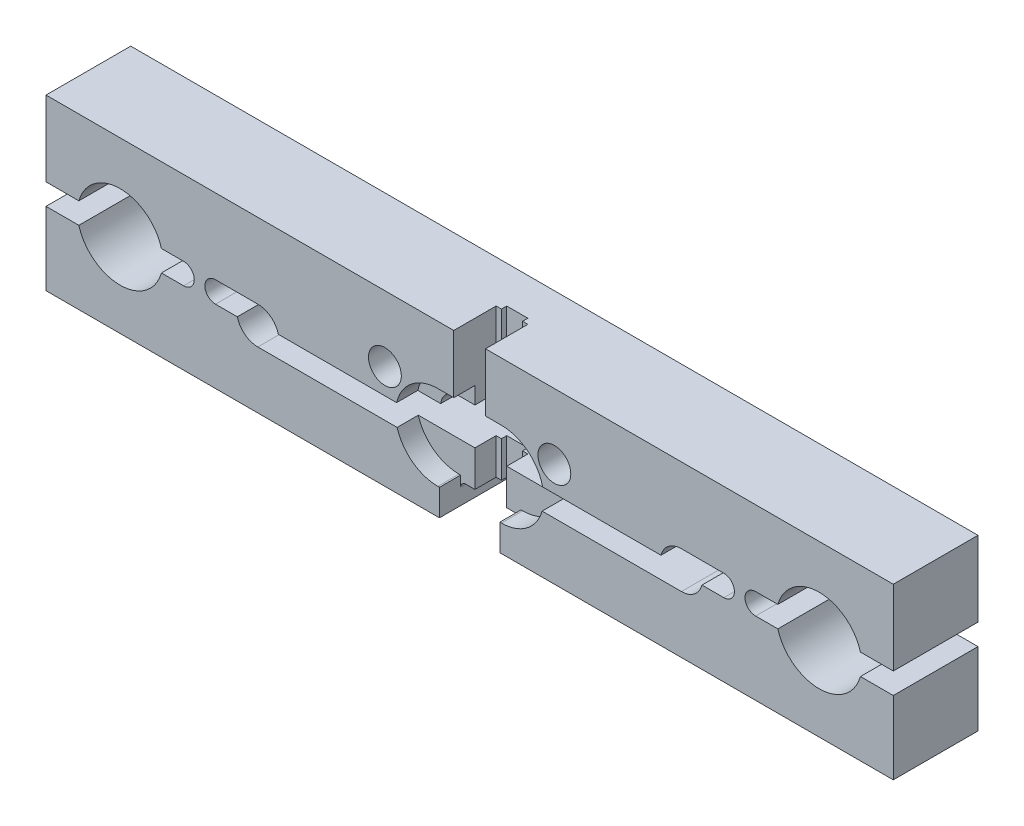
SolidWorks part; units mm, degrees
ref_plane "前视基准面" through (0, 0, 0) normal (0, 0, 1) x (1, 0, 0)
ref_plane "上视基准面" through (0, 0, 0) normal (0, 1, 0) x (1, 0, 0)
ref_plane "右视基准面" through (0, 0, 0) normal (1, 0, 0) x (0, 0, -1)
sketch "前视图草图" plane through (0, 0, 0) normal (0, 0, 1) x (1, 0, 0)
  line L0 (0, 0) -> (44.4821, 0) construction
  line L1 (0, 0) -> (0, 28.3185) construction
sketch "草图2" plane through (0, 0, 0) normal (0, 0, 1) x (1, 0, 0)
  line L0 (0, 0) -> (80, 0)
  line L1 (-200000, 0) -> (200044.4821, 0) construction
  line L2 (80, 0) -> (80, 16)
  line L3 (80, 16) -> (0, 16)
  line L4 (0, -200000) -> (0, 200028.3185) construction
  line L5 (0, 16) -> (0, 0)
  line L6 (7, 17.2957) -> (7, -8.7712) construction
  line L7 (73, 25.8617) -> (73, -10.6533) construction
  arc A0 (11.0488, 7.9) -> (2.9512, 7.9) centre (7, 7.8) ccw
  arc A2 (77.0488, 7.9) -> (68.9512, 7.9) centre (73, 7.8) ccw
  arc A3 (2.9512, 7.9) -> (11.0488, 7.9) centre (7, 8) ccw
  arc A4 (68.9512, 7.9) -> (77.0488, 7.9) centre (73, 8) ccw
  dimension "D3" = 7.8
  dimension "D5" = 8.1
  dimension "D9" = 8.1
  dimension "D10" = 8.1
  dimension "D11" = 8
  dimension "D12" = 8.1
  dimension "D1" = 16
  dimension "D2" = 80
  dimension "D4" = 7
  dimension "D7" = 7.8
  dimension "D14" = 8
  dimension "D21" = 7
extrude "凸台-拉伸1" add sketch "草图2" along normal blind 8
sketch "草图5" plane through (0, 0, 8) normal (0, 0, 1) x (1, 0, 0)
  line L0 (40, 9.8) -> (56.5376, 9.8) construction
  line L1 (0, -200000) -> (0, 200028.3185) construction
  line L2 (-200000, 0) -> (200044.4821, 0) construction
  circle A0 centre (40, 9.8) radius 8 construction
  circle A1 centre (48, 9.8) radius 1.55
  circle A2 centre (32, 9.8) radius 1.55
  dimension "D1" = 3.1
  dimension "D2" = 3.1
  dimension "D3" = 16
  dimension "D4" = 40
  dimension "D5" = 9.8
extrude "切除-拉伸3" cut sketch "草图5" against normal through all
sketch "草图6" plane through (0, 0, 8) normal (0, 0, 1) x (1, 0, 0)
  line L0 (-14.1885, 7.9) -> (-5.4375, 7.9) construction
  line L1 (-200000, 0) -> (200044.4821, 0) construction
  line L2 (0, 8.9) -> (0, 6.9)
  line L3 (0, -200000) -> (0, 200028.3185) construction
  line L4 (0, 6.9) -> (13, 6.9)
  line L5 (80, 0) -> (80, 16) construction
  line L6 (80, 6.9) -> (80, 8.9)
  line L7 (80, 8.9) -> (67, 8.9)
  line L10 (61.9365, 6.9) -> (64, 6.9)
  line L11 (20, 8.9) -> (16, 8.9)
  line L13 (20, 5.4) -> (60, 5.4)
  line L15 (58.0635, 7.4) -> (21.9365, 7.4)
  line L16 (20, 1015.1838) -> (20, 8.9) construction
  line L17 (60, 25.2492) -> (60, 8.9) construction
  line L18 (20, 5.4) -> (20, -1004.4799) construction
  line L20 (60, 5.4) -> (60, -19.6999) construction
  line L21 (16, 6.9) -> (18.0635, 6.9)
  line L25 (13, 8.9) -> (0, 8.9)
  line L26 (67, 6.9) -> (80, 6.9)
  line L27 (64, 8.9) -> (60, 8.9)
  arc A1 (20, 8.9) -> (22, 6.9) centre (20, 6.9) cw
  arc A2 (18, 7.4) -> (20, 5.4) centre (20, 7.4) ccw
  arc A3 (60, 5.4) -> (62, 7.4) centre (60, 7.4) ccw
  arc A4 (60, 8.9) -> (58, 6.9) centre (60, 6.9) ccw
  arc A5 (13, 6.9) -> (13, 8.9) centre (13, 7.9) ccw
  arc A6 (16, 8.9) -> (16, 6.9) centre (16, 7.9) ccw
  arc A7 (67, 8.9) -> (67, 6.9) centre (67, 7.9) ccw
  arc A8 (64, 6.9) -> (64, 8.9) centre (64, 7.9) ccw
  dimension "D5" = 13
  dimension "D1" = 7.9
  dimension "D2" = 2
  dimension "D3" = 1
  dimension "D4" = 20
  dimension "D6" = 2
  dimension "D7" = 0.5
  dimension "D8" = 16
  dimension "D9" = 20
  dimension "D10" = 13
  dimension "D11" = 16
extrude "切除-拉伸4" cut sketch "草图6" against normal through all
sketch "草图7" plane through (0, 0, 8) normal (0, 0, 1) x (1, 0, 0)
  line L0 (-200000, 0) -> (200044.4821, 0) construction
  line L1 (0, -200000) -> (0, 200028.3185) construction
  line L2 (80, 0) -> (80, 6.9) construction
  line L3 (77, -2) -> (74, -2)
  line L4 (77, 0) -> (74, 0)
  line L5 (6, 0) -> (3, 0)
  line L6 (6, -2) -> (3, -2)
  circle A0 centre (3, -1) radius 1
  circle A1 centre (6, -1) radius 1
  circle A2 centre (74, -1) radius 1
  circle A3 centre (77, -1) radius 1
  dimension "D1" = 2
  dimension "D2" = 2
  dimension "D3" = 2
  dimension "D4" = 2
  dimension "D5" = 3
  dimension "D6" = 6
  dimension "D7" = 3
  dimension "D8" = 6
sketch "草图8" plane through (0, 0, 8) normal (0, 0, 1) x (1, 0, 0)
  line L0 (38.5, 16) -> (41.5, 16)
  line L1 (80, 16) -> (0, 16) construction
  line L2 (41.5, 16) -> (41.5, 0)
  line L3 (-200000, 0) -> (200044.4821, 0) construction
  line L4 (41.5, 0) -> (38.5, 0)
  line L5 (38.5, 0) -> (38.5, 16)
  line L6 (0, -200000) -> (0, 200028.3185) construction
  dimension "D1" = 3
  dimension "D2" = 38.5
extrude "切除-拉伸5" cut sketch "草图8" against normal blind 4
sketch "草图9" plane through (0, 0, 8) normal (0, 0, 1) x (1, 0, 0)
  line L0 (37.15, 0) -> (42.85, 0)
  line L1 (-200000, 0) -> (200044.4821, 0) construction
  line L2 (42.85, 0) -> (42.85, 2)
  line L3 (42.85, 2) -> (37.15, 2)
  line L4 (37.15, 2) -> (37.15, 0)
  line L5 (0, -200000) -> (0, 200028.3185) construction
  circle A0 centre (37.65, 1.5) radius 0.5
  circle A1 centre (42.35, 1.5) radius 0.5
  point P4 (40, 0)
  dimension "D2" = 1
  dimension "D3" = 1
  dimension "D1" = 2
  dimension "D4" = 5.7
  dimension "D5" = 37.15
extrude "切除-拉伸6" cut sketch "草图9" against normal through all contours A0 | A1 | A1 L3 L0 L2 M18 | A0 L4 L3 M17 M18
sketch "草图10" plane through (0, 0, 8) normal (0, 0, 1) x (1, 0, 0)
  line L0 (-16.167, 6.5) -> (-7.3119, 6.5) construction
  line L1 (-200000, 0) -> (200044.4821, 0) construction
  line L2 (37, 25.4789) -> (37, 22.1592) construction
  line L3 (40, 28.0379) -> (40, 22.1592) construction
  line L4 (43, 28.0379) -> (43, 22.1592) construction
  line L5 (0, -200000) -> (0, 200028.3185) construction
  line L6 (80, 8.9) -> (80, 16) construction
  line L7 (37, 10.5) -> (43, 10.5)
  line L8 (43, 2.5) -> (37, 2.5)
  arc A0 (37, 10.5) -> (37, 2.5) centre (37, 6.5) ccw
  arc A1 (43, 2.5) -> (43, 10.5) centre (43, 6.5) ccw
  dimension "D5" = 8
  dimension "D6" = 8
  dimension "D1" = 6.5
  dimension "D2" = 40
  dimension "D3" = 37
  dimension "D4" = 37
extrude "切除-拉伸7" cut sketch "草图10" against normal blind 2
sketch "草图11" plane through (0, 0, 8) normal (0, 0, 1) x (1, 0, 0)
  line L0 (38.5, 5.4) -> (33.1542, 5.4) construction
  line L1 (46.8458, 5.4) -> (41.5, 5.4) construction
  line L2 (0, -200000) -> (0, 200028.3185) construction
  line L3 (80, 0) -> (80, 6.9) construction
  line L5 (37, 5.4) -> (43, 5.4)
  line L6 (37, 8.9) -> (43, 8.9)
  arc A0 (37, 8.9) -> (37, 5.4) centre (37, 7.15) ccw
  arc A1 (43, 5.4) -> (43, 8.9) centre (43, 7.15) ccw
  dimension "D1" = 3.5
  dimension "D2" = 3.5
  dimension "D3" = 37
  dimension "D4" = 37
extrude "切除-拉伸8" cut sketch "草图11" against normal through all
sketch "草图12" plane through (0, 0, 8) normal (0, 0, 1) x (1, 0, 0)
  line L0 (37.15, 0) -> (37.15, 2.5)
  line L1 (37, 2.5) -> (38.5, 2.5) construction
  line L2 (37.15, 2.5) -> (42.85, 2.5)
  line L3 (41.5, 2.5) -> (43, 2.5) construction
  line L4 (42.85, 2.5) -> (42.85, 0)
  line L5 (42.85, 0) -> (37.15, 0)
extrude "切除-拉伸9" cut sketch "草图12" against normal blind 2
sketch "草图13" plane through (0, 0, 4) normal (0, 0, 1) x (1, 0, 0)
  line L0 (40, 22.0777) -> (40, 18.5696) construction
  line L1 (0, -200000) -> (0, 200028.3185) construction
  line L2 (39, 16) -> (41, 16)
  line L3 (41.5, 16) -> (38.5, 16) construction
  line L4 (41, 16) -> (41, 2)
  line L5 (38.5, 2) -> (41.5, 2) construction
  line L6 (41, 2) -> (39, 2)
  line L7 (39, 2) -> (39, 16)
  dimension "D1" = 40
  dimension "D2" = 2
  dimension "D3" = 1
extrude "切除-拉伸10" cut sketch "草图13" against normal blind 0.5
